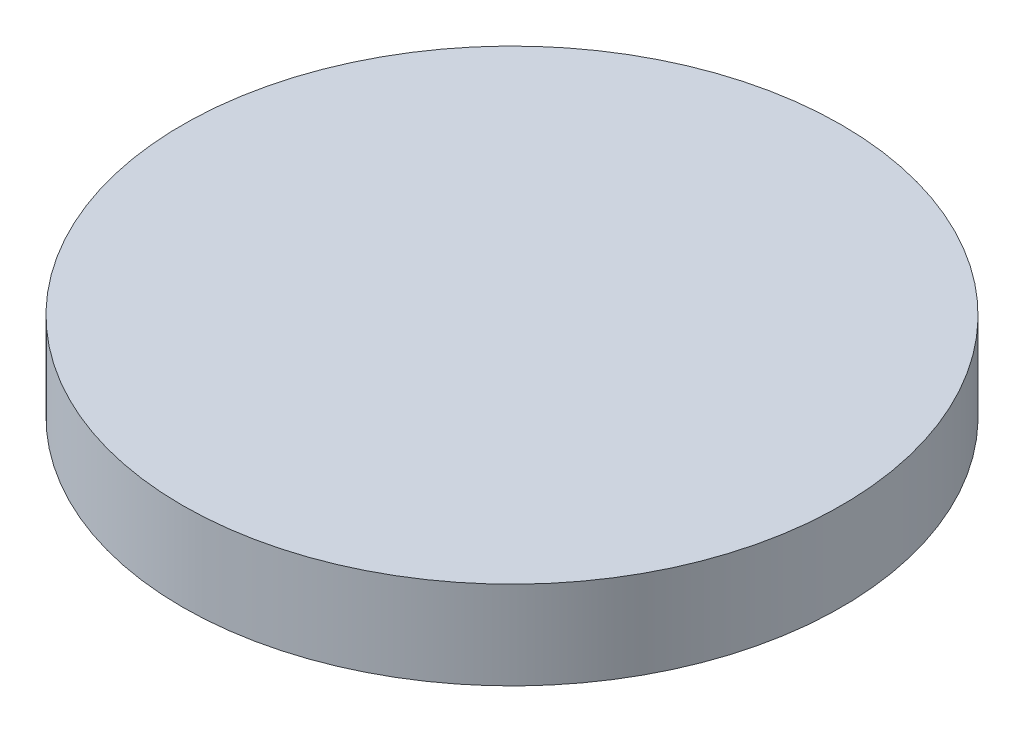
SolidWorks part; units mm, degrees
ref_plane "Front Plane" through (0, 0, 0) normal (0, 0, 1) x (1, 0, 0)
ref_plane "Top Plane" through (0, 0, 0) normal (0, 1, 0) x (1, 0, 0)
ref_plane "Right Plane" through (0, 0, 0) normal (1, 0, 0) x (0, 0, -1)
sketch "Sketch1" plane through (0, 0, 0) normal (0, 1, 0) x (1, 0, 0)
  circle A0 centre (0, 0) radius 9.5
  dimension "D1" = 19
extrude "Boss-Extrude1" add sketch "Sketch1" along normal mid plane 2.54
